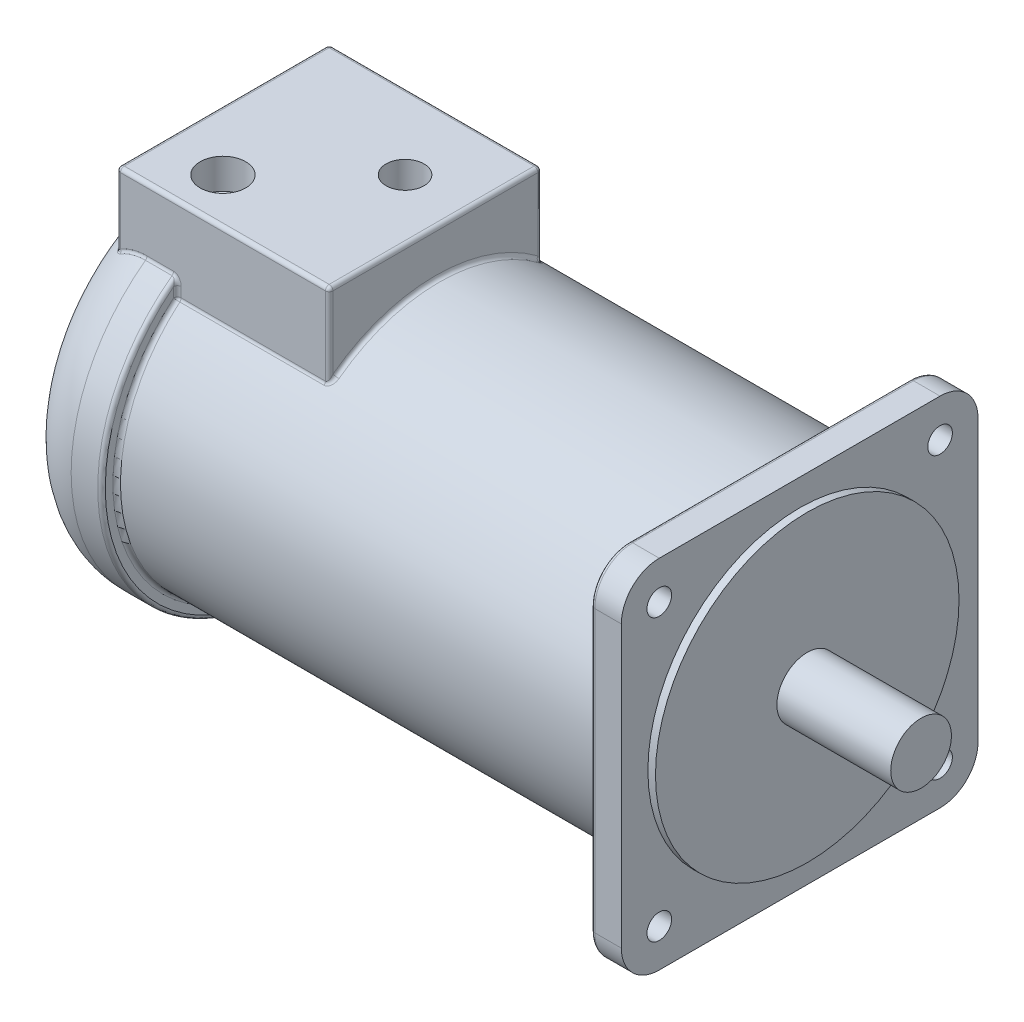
SolidWorks part; units mm, degrees
ref_plane "front" through (0, 0, 0) normal (0, 0, 1) x (1, 0, 0)
ref_plane "top" through (0, 0, 0) normal (0, 1, 0) x (1, 0, 0)
ref_plane "side" through (0, 0, 0) normal (1, 0, 0) x (0, 0, -1)
sketch "Sketch1" plane through (0, 0, 0) normal (0, 0, 1) x (1, 0, 0)
  line L0 (0, 0) -> (63.4876, 0) construction
  line L1 (0, 0) -> (0, 12.7)
  line L2 (0, 12.7) -> (-50.8, 12.7)
  line L3 (-50.8, 12.7) -> (-50.8, 69.85)
  line L6 (-50.8, 69.85) -> (-266.7, 69.85)
  line L7 (-266.7, 69.85) -> (-266.7, 76.2)
  line L8 (-266.7, 76.2) -> (-279.4, 76.2)
  line L9 (-304.8, 50.8) -> (-304.8, 0)
  line L10 (-304.8, 0) -> (0, 0)
  arc A0 (-279.4, 76.2) -> (-304.8, 50.8) centre (-279.4, 50.8) ccw
  dimension "D3" = 25.4
  dimension "D1" = 69.85
  dimension "D2" = 76.2
  dimension "D4" = 38.1
  dimension "D5" = 254
  dimension "D6" = 50.8
  dimension "D7" = 25.4
revolve "Base-Revolve" add sketch "Sketch1" angle 360 about L0
sketch "Sketch2" plane through (-50.8, 0, 0) normal (1, 0, 0) x (0, 0, -1)
  line L0 (0, 0) -> (0, 105.8986) construction
  line L1 (0, 0) -> (105.8986, 0) construction
  line L2 (74.6125, -58.7375) -> (74.6125, 58.7375)
  line L3 (58.7375, 74.6125) -> (-58.7375, 74.6125)
  line L4 (-74.6125, -58.7375) -> (-74.6125, 58.7375)
  line L5 (58.7375, -74.6125) -> (-58.7375, -74.6125)
  arc A0 (74.6125, 58.7375) -> (58.7375, 74.6125) centre (58.7375, 58.7375) ccw
  arc A1 (-74.6125, 58.7375) -> (-58.7375, 74.6125) centre (-58.7375, 58.7375) cw
  arc A2 (-74.6125, -58.7375) -> (-58.7375, -74.6125) centre (-58.7375, -58.7375) ccw
  arc A3 (74.6125, -58.7375) -> (58.7375, -74.6125) centre (58.7375, -58.7375) cw
  point P10 (0, 74.6125)
  point P11 (74.6125, 0)
  point P18 (-74.6125, 0)
  point P19 (0, -74.6125)
  dimension "D1" = 15.875
  dimension "D2" = 149.225
extrude "Boss-Extrude1" add sketch "Sketch2" against normal blind 12.7
ref_plane "Plane4" through (-203.2, 0, 0) normal (1, 0, 0) x (0, 0, -1)
sketch "Sketch3" plane through (-203.2, 0, 0) normal (1, 0, 0) x (0, 0, -1)
  line L0 (0, 0) -> (0, 88.9) construction
  line L1 (-44.45, 88.9) -> (44.45, 88.9)
  line L2 (-44.45, 88.9) -> (-44.45, 24.5934)
  line L3 (44.45, 24.5934) -> (-44.45, 24.5934)
  line L4 (44.45, 24.5934) -> (44.45, 88.9)
  circle A3 centre (0, 0) radius 50.8 construction
  circle A4 centre (0, 0) radius 12.7 construction
  dimension "D2" = 88.9
  dimension "D1" = 88.9
extrude "Boss-Extrude2" add sketch "Sketch3" against normal blind 88.9
sketch "Sketch4" plane through (-50.8, 0, 0) normal (1, 0, 0) x (0, 0, -1)
  circle A0 centre (0, 0) radius 63.5
  dimension "D1" = 127
extrude "pilot dia" add sketch "Sketch4" along normal blind 3.175
sketch "Sketch5" plane through (-50.8, 0, 0) normal (1, 0, 0) x (0, 0, -1)
  circle A0 centre (58.7375, 58.7375) radius 5.1562
  dimension "D1" = 10.3124
extrude "Cut-Extrude1" cut sketch "Sketch5" against normal up to next
pattern_linear "LPattern1" count 2 spacing 117.475 along (0, 0, 1) count 2 spacing 117.475 along (0, -1, 0) of "Cut-Extrude1"
sketch "Sketch6" plane through (0, 88.9, 0) normal (0, 1, 0) x (-1, 0, 0)
  line L0 (292.1, 44.45) -> (292.1, -44.45) construction
  line L1 (292.1, -44.45) -> (203.2, -44.45) construction
  circle A0 centre (266.7, 25.4) radius 9.525
  circle A1 centre (228.6, -12.7) radius 7.9375
  dimension "D1" = 25.4
  dimension "D2" = 38.1
  dimension "D3" = 31.75
  dimension "D4" = 38.1
  dimension "D5" = 19.05
  dimension "D6" = 15.875
extrude "Cut-Extrude2" cut sketch "Sketch6" against normal blind 12.7
fillet "Fillet1" radius 1.5875 7 edges at (-283.451, 61.4914, -44.45) (-266.7, -76.2, 0) (-266.7, -69.85, 0) (-203.2, 71.3908, 44.45) (-203.2, 71.3908, -44.45) (-292.1, 73.2754, 44.45) (-292.1, 73.2754, -44.45)
fillet "Fillet2" radius 1.5875 18 edges at (-234.95, 53.8815, -44.45) (-266.7, 57.9255, -44.45) (-283.451, 61.4914, -44.45) (-265.9382, 54.1815, -44.45) (-292.1, 72.797, 0) (-203.6546, 54.2703, 43.9745) (-203.9612, 54.0721, -44.218) (-291.5521, 58.3333, -44.0623) (-291.6887, 58.3401, 43.9287) (-267.0974, 61.23, 44.45) (-267.1536, 61.3046, -44.45) (-273.5277, -61.0429, 44.45) (-273.8438, 61.8921, -44.45) (-203.2, 69.85, 0) (-234.95, 53.8815, 44.45) (-273.8438, 61.8921, 44.45) (-266.7, 57.9255, 44.45) (-266.2494, 54.5017, 44.45)
fillet "Fillet3" radius 1.5875 17 edges at (-291.635, 88.9, 43.985) (-291.635, 88.9, -43.985) (-203.665, 88.9, -43.985) (-203.665, 88.9, 43.985) (-63.5, 0, -69.85) (-63.5, -69.9628, -69.9628) (-63.5, -74.6125, 0) (-63.5, 0, 74.6125) (-63.5, 69.9628, 69.9628) (-63.5, 69.9628, -69.9628) (-63.5, 0, -74.6125) (-63.5, -69.9628, 69.9628) (-63.5, 74.6125, 0) (-203.2, 88.9, 0) (-247.65, 88.9, 44.45) (-247.65, 88.9, -44.45) (-292.1, 88.9, 0)
